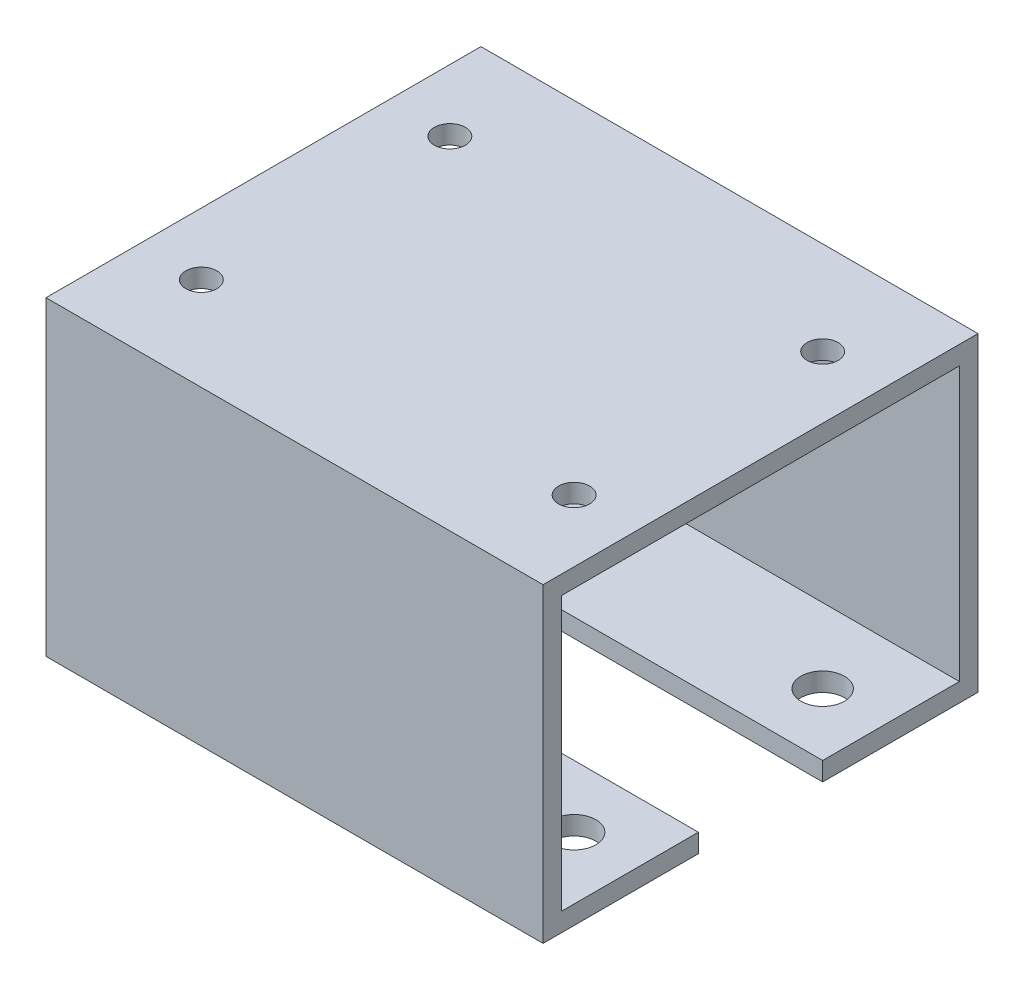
SolidWorks part; units mm, degrees
ref_plane "正面" through (0, 0, 0) normal (0, 0, 1) x (1, 0, 0)
ref_plane "平面" through (0, 0, 0) normal (0, 1, 0) x (1, 0, 0)
ref_plane "右側面" through (0, 0, 0) normal (1, 0, 0) x (0, 0, -1)
sketch "layout1" plane through (0, 0, 0) normal (0, 1, 0) x (1, 0, 0)
  line L0 (-30, 20) -> (30, -20) construction
  line L1 (-30, 20) -> (30, 20) construction
  line L2 (-30, 20) -> (-30, -20) construction
  line L3 (-30, -20) -> (30, -20) construction
  line L4 (30, 20) -> (30, -20) construction
  line L5 (30, 20) -> (-30, -20) construction
  circle A0 centre (-30, 20) radius 3.5
  circle A1 centre (30, 20) radius 3.5
  circle A2 centre (-30, -20) radius 3.5
  circle A3 centre (30, -20) radius 3.5
  point P4 (0, 0)
  dimension "D3" = 7
  dimension "D1" = 60
  dimension "D2" = 40
sketch "layout2" plane through (0, 0, 0) normal (0, 1, 0) x (1, 0, 0)
  circle A0 centre (-30, 20) radius 5
  circle A1 centre (30, 20) radius 5
  circle A2 centre (-30, -20) radius 5
  circle A3 centre (30, -20) radius 5
  dimension "D1" = 10
ref_plane "平面1" through (0, 50, 0) normal (0, 1, 0) x (-1, 0, 0)
sketch "ｽｹｯﾁ3" plane through (0, 0, 0) normal (0, 1, 0) x (1, 0, 0)
  line L0 (30, 20) -> (30, -20) construction
  line L1 (-40, 35) -> (40, 35)
  line L2 (-40, 35) -> (-40, -35)
  line L3 (-40, -35) -> (40, -35)
  line L4 (40, 35) -> (40, -35)
  dimension "D1" = 10
  dimension "D2" = 10
  dimension "D3" = 15
  dimension "D4" = 15
extrude "押し出し1" add sketch "ｽｹｯﾁ3" along normal up to surface (50 mm away)
shell "ｼｪﾙ1" thickness 3
sketch "ｽｹｯﾁ4" plane through (0, 0, 0) normal (0, 1, 0) x (1, 0, 0)
  line L0 (-40, 35) -> (-40, -35) construction
  line L1 (-40, 10) -> (40, 10)
  line L2 (-40, 10) -> (-40, -10)
  line L3 (-40, -10) -> (40, -10)
  line L4 (40, 10) -> (40, -10)
  line L5 (40, -35) -> (40, 35) construction
  dimension "D1" = 10
  dimension "D2" = 10
  dimension "D3" = 20
extrude "ｶｯﾄ - 押し出し1" cut sketch "ｽｹｯﾁ4" along normal up to next
sketch "ｽｹｯﾁ5" plane through (0, 3, 0) normal (0, 1, 0) x (1, 0, 0)
  circle A0 centre (30, -20) radius 3.5 construction
  circle A1 centre (-30, -20) radius 3.5 construction
  circle A2 centre (-30, 20) radius 3.5 construction
  circle A3 centre (30, 20) radius 3.5 construction
  circle A4 centre (30, -20) radius 3.5
  circle A5 centre (-30, -20) radius 3.5
  circle A6 centre (-30, 20) radius 3.5
  circle A7 centre (30, 20) radius 3.5
extrude "ｶｯﾄ - 押し出し2" cut sketch "ｽｹｯﾁ5" against normal through all
hole_wizard "M6x1.0 ねじ穴2" positions "ｽｹｯﾁ9" profile "ｽｹｯﾁ8" tap size "M6x1.0" standard "JIS"
sketch "ｽｹｯﾁ9" plane through (0, 50, 0) normal (0, 1, 0) x (-1, 0, 0)
  point P3 (30, -20)
  point P6 (30, 20)
  point P9 (-30, 20)
  point P12 (-30, -20)
sketch "ｽｹｯﾁ8" plane through (-30, 50, -20) normal (1, 0, 0) x (0, 0, 1)
  line L0 (0, 0) -> (0, 3)
  line L1 (0, 3) -> (2.5, 3)
  line L2 (2.5, 3) -> (2.5, 0)
  line L5 (2.5, 0) -> (0, 0)
  line L11 (0, -6.35) -> (0, 107.95) construction
  dimension "次ｻｰﾌｪｽまでのねじ下穴ﾄﾞﾘﾙの直径" = 5
  dimension "次ｻｰﾌｪｽまでのねじ下穴ﾄﾞﾘﾙの深さ" = 3
